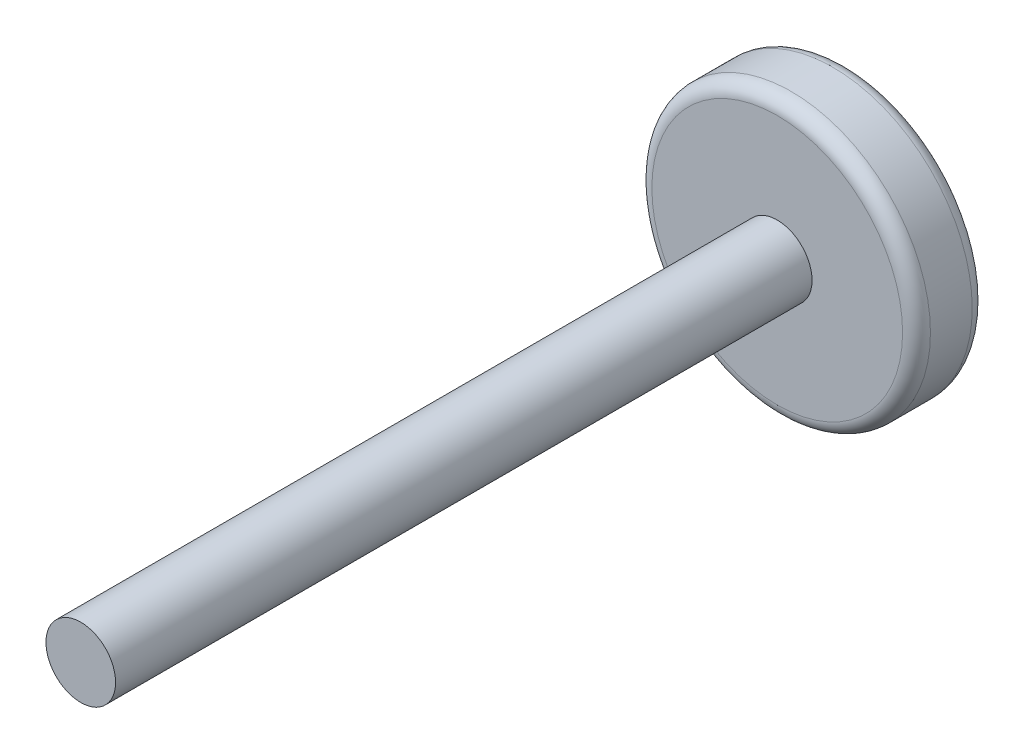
SolidWorks part; units mm, degrees
ref_plane "Plan de face" through (0, 0, 0) normal (0, 0, 1) x (1, 0, 0)
ref_plane "Plan de dessus" through (0, 0, 0) normal (0, 1, 0) x (1, 0, 0)
ref_plane "Plan de droite" through (0, 0, 0) normal (1, 0, 0) x (0, 0, -1)
sketch "Esquisse1" plane through (0, 0, 0) normal (0, 0, 1) x (1, 0, 0)
  circle A0 centre (0, 0) radius 10
extrude "Boss.-Extru.1" add sketch "Esquisse1" along normal blind 5
fillet "Congé1" radius 1 2 edges at (10, 0, 0) (10, 0, 5)
sketch "Esquisse2" plane through (0, 0, 5) normal (0, 0, 1) x (1, 0, 0)
  circle A0 centre (0, 0) radius 2.5
extrude "Boss.-Extru.2" add sketch "Esquisse2" along normal blind 50
